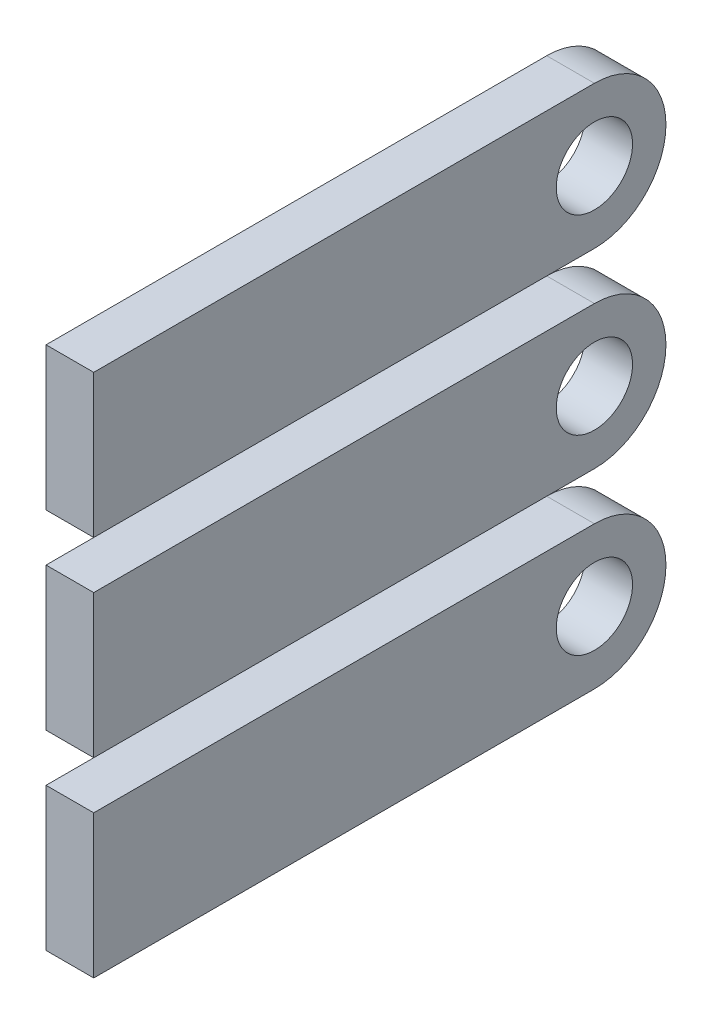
SolidWorks part; units mm, degrees
ref_plane "Přední rovina" through (0, 0, 0) normal (0, 0, 1) x (1, 0, 0)
ref_plane "Horní rovina" through (0, 0, 0) normal (0, 1, 0) x (1, 0, 0)
ref_plane "Pravá rovina" through (0, 0, 0) normal (1, 0, 0) x (0, 0, -1)
sketch "Skica1" plane through (0, 0, 0) normal (0, 0, 1) x (1, 0, 0)
  line L0 (0, 148.7514) -> (0, -162.0328) construction
  line L1 (-203.1858, 0) -> (251.9227, 0) construction
  line L2 (1.4, 79.8) -> (1.4, 78.4875)
  line L3 (0, 78.39) -> (0, 88.6)
  line L4 (-2.8, 88.6) -> (2.8, 88.6)
  line L5 (0, 88.6) -> (0, 80.4)
  line L6 (-1.9, 80.4) -> (1.9, 80.4)
  line L7 (0, 80.4) -> (0, 79.8)
  line L8 (6.5145, 80.1582) -> (10.2937, 79.761)
  line L9 (1.4, 79.8) -> (1.9, 80.4)
  line L10 (2.8, 88.6) -> (1.9, 80.4)
  line L11 (-1.4, 79.8) -> (-1.9, 80.4)
  line L12 (-2.8, 88.6) -> (-1.9, 80.4)
  line L13 (6.4766, 88.4073) -> (6.5145, 80.1582)
  line L14 (6.4766, 88.4073) -> (12.0459, 87.822)
  line L15 (12.0459, 87.822) -> (10.2937, 79.761)
  line L16 (6.949, 79.5092) -> (6.5145, 80.1582)
  line L17 (14.8576, 79.0381) -> (18.5746, 78.248)
  line L18 (9.7337, 79.2165) -> (10.2937, 79.761)
  line L19 (15.6822, 87.246) -> (14.8576, 79.0381)
  line L20 (15.6822, 87.246) -> (21.1598, 86.0817)
  line L21 (21.1598, 86.0817) -> (18.5746, 78.248)
  line L22 (15.2219, 78.3473) -> (14.8576, 79.0381)
  line L23 (23.038, 77.0521) -> (26.652, 75.8778)
  line L24 (17.9608, 77.7651) -> (18.5746, 78.248)
  line L25 (24.7159, 85.1289) -> (23.038, 77.0521)
  line L26 (24.7159, 85.1289) -> (30.0419, 83.3984)
  line L27 (30.0419, 83.3984) -> (26.652, 75.8778)
  line L28 (23.3281, 76.3269) -> (23.038, 77.0521)
  line L29 (30.9659, 74.2219) -> (34.4374, 72.6763)
  line L30 (25.991, 75.4617) -> (26.652, 75.8778)
  line L31 (33.4789, 82.079) -> (30.9659, 74.2219)
  line L32 (33.4789, 82.079) -> (38.5948, 79.8013)
  line L33 (38.5948, 79.8013) -> (34.4374, 72.6763)
  line L34 (31.1786, 73.4704) -> (30.9659, 74.2219)
  line L35 (38.5546, 70.5784) -> (41.8454, 68.6784)
  line L36 (33.7365, 72.3315) -> (34.4374, 72.6763)
  line L37 (41.8751, 78.1299) -> (38.5546, 70.5784)
  line L38 (41.8751, 78.1299) -> (46.7249, 75.3299)
  line L39 (46.7249, 75.3299) -> (41.8454, 68.6784)
  line L40 (38.6876, 69.8088) -> (38.5546, 70.5784)
  line L41 (45.7208, 66.1618) -> (48.7951, 63.9282)
  line L42 (41.1124, 68.4088) -> (41.8454, 68.6784)
  line L43 (49.8125, 73.3247) -> (45.7208, 66.1618)
  line L44 (49.8125, 73.3247) -> (54.343, 70.0331)
  line L45 (54.343, 70.0331) -> (48.7951, 63.9282)
  line L46 (45.7726, 65.3825) -> (45.7208, 66.1618)
  line L47 (52.3861, 61.0202) -> (55.2101, 58.4775)
  line L48 (48.0379, 63.7367) -> (48.7951, 63.9282)
  line L49 (57.2042, 67.7162) -> (52.3861, 61.0202)
  line L50 (57.2042, 67.7162) -> (61.3658, 63.9691)
  line L51 (61.3658, 63.9691) -> (55.2101, 58.4775)
  line L52 (52.3562, 60.2397) -> (52.3861, 61.0202)
  line L53 (58.4775, 55.2101) -> (61.0202, 52.3861)
  line L54 (54.437, 58.3662) -> (55.2101, 58.4775)
  line L55 (63.9691, 61.3658) -> (58.4775, 55.2101)
  line L56 (63.9691, 61.3658) -> (67.7162, 57.2042)
  line L57 (67.7162, 57.2042) -> (61.0202, 52.3861)
  line L58 (58.3662, 54.437) -> (58.4775, 55.2101)
  line L59 (63.9282, 48.7951) -> (66.1618, 45.7208)
  line L60 (60.2397, 52.3562) -> (61.0202, 52.3861)
  line L61 (70.0331, 54.343) -> (63.9282, 48.7951)
  line L62 (70.0331, 54.343) -> (73.3247, 49.8125)
  line L63 (73.3247, 49.8125) -> (66.1618, 45.7208)
  line L64 (63.7367, 48.0379) -> (63.9282, 48.7951)
  line L65 (68.6784, 41.8454) -> (70.5784, 38.5546)
  line L66 (65.3825, 45.7726) -> (66.1618, 45.7208)
  line L67 (75.3299, 46.7249) -> (68.6784, 41.8454)
  line L68 (75.3299, 46.7249) -> (78.1299, 41.8751)
  line L69 (78.1299, 41.8751) -> (70.5784, 38.5546)
  line L70 (68.4088, 41.1124) -> (68.6784, 41.8454)
  line L71 (72.6763, 34.4374) -> (74.2219, 30.9659)
  line L72 (69.8088, 38.6876) -> (70.5784, 38.5546)
  line L73 (79.8013, 38.5948) -> (72.6763, 34.4374)
  line L74 (79.8013, 38.5948) -> (82.079, 33.4789)
  line L75 (82.079, 33.4789) -> (74.2219, 30.9659)
  line L76 (72.3315, 33.7365) -> (72.6763, 34.4374)
  line L77 (75.8778, 26.652) -> (77.0521, 23.038)
  line L78 (73.4704, 31.1786) -> (74.2219, 30.9659)
  line L79 (83.3984, 30.0419) -> (75.8778, 26.652)
  line L80 (83.3984, 30.0419) -> (85.1289, 24.7159)
  line L81 (85.1289, 24.7159) -> (77.0521, 23.038)
  line L82 (75.4617, 25.991) -> (75.8778, 26.652)
  line L83 (78.248, 18.5746) -> (79.0381, 14.8576)
  line L84 (76.3269, 23.3281) -> (77.0521, 23.038)
  line L85 (86.0817, 21.1598) -> (78.248, 18.5746)
  line L86 (86.0817, 21.1598) -> (87.246, 15.6822)
  line L87 (87.246, 15.6822) -> (79.0381, 14.8576)
  line L88 (77.7651, 17.9608) -> (78.248, 18.5746)
  line L89 (79.761, 10.2937) -> (80.1582, 6.5145)
  line L90 (78.3473, 15.2219) -> (79.0381, 14.8576)
  line L91 (87.822, 12.0459) -> (79.761, 10.2937)
  line L92 (87.822, 12.0459) -> (88.4073, 6.4766)
  line L93 (88.4073, 6.4766) -> (80.1582, 6.5145)
  line L94 (79.2165, 9.7337) -> (79.761, 10.2937)
  line L95 (80.4, 1.9) -> (80.4, -1.9)
  line L96 (79.5092, 6.949) -> (80.1582, 6.5145)
  line L97 (88.6, 2.8) -> (80.4, 1.9)
  line L98 (88.6, 2.8) -> (88.6, -2.8)
  line L99 (88.6, -2.8) -> (80.4, -1.9)
  line L100 (79.8, 1.4) -> (80.4, 1.9)
  line L101 (80.1582, -6.5145) -> (79.761, -10.2937)
  line L102 (79.8, -1.4) -> (80.4, -1.9)
  line L103 (88.4073, -6.4766) -> (80.1582, -6.5145)
  line L104 (88.4073, -6.4766) -> (87.822, -12.0459)
  line L105 (87.822, -12.0459) -> (79.761, -10.2937)
  line L106 (79.5092, -6.949) -> (80.1582, -6.5145)
  line L107 (79.0381, -14.8576) -> (78.248, -18.5746)
  line L108 (79.2165, -9.7337) -> (79.761, -10.2937)
  line L109 (87.246, -15.6822) -> (79.0381, -14.8576)
  line L110 (87.246, -15.6822) -> (86.0817, -21.1598)
  line L111 (86.0817, -21.1598) -> (78.248, -18.5746)
  line L112 (78.3473, -15.2219) -> (79.0381, -14.8576)
  line L113 (77.0521, -23.038) -> (75.8778, -26.652)
  line L114 (77.7651, -17.9608) -> (78.248, -18.5746)
  line L115 (85.1289, -24.7159) -> (77.0521, -23.038)
  line L116 (85.1289, -24.7159) -> (83.3984, -30.0419)
  line L117 (83.3984, -30.0419) -> (75.8778, -26.652)
  line L118 (76.3269, -23.3281) -> (77.0521, -23.038)
  line L119 (74.2219, -30.9659) -> (72.6763, -34.4374)
  line L120 (75.4617, -25.991) -> (75.8778, -26.652)
  line L121 (82.079, -33.4789) -> (74.2219, -30.9659)
  line L122 (82.079, -33.4789) -> (79.8013, -38.5948)
  line L123 (79.8013, -38.5948) -> (72.6763, -34.4374)
  line L124 (73.4704, -31.1786) -> (74.2219, -30.9659)
  line L125 (70.5784, -38.5546) -> (68.6784, -41.8454)
  line L126 (72.3315, -33.7365) -> (72.6763, -34.4374)
  line L127 (78.1299, -41.8751) -> (70.5784, -38.5546)
  line L128 (78.1299, -41.8751) -> (75.3299, -46.7249)
  line L129 (75.3299, -46.7249) -> (68.6784, -41.8454)
  line L130 (69.8088, -38.6876) -> (70.5784, -38.5546)
  line L131 (66.1618, -45.7208) -> (63.9282, -48.7951)
  line L132 (68.4088, -41.1124) -> (68.6784, -41.8454)
  line L133 (73.3247, -49.8125) -> (66.1618, -45.7208)
  line L134 (73.3247, -49.8125) -> (70.0331, -54.343)
  line L135 (70.0331, -54.343) -> (63.9282, -48.7951)
  line L136 (65.3825, -45.7726) -> (66.1618, -45.7208)
  line L137 (61.0202, -52.3861) -> (58.4775, -55.2101)
  line L138 (63.7367, -48.0379) -> (63.9282, -48.7951)
  line L139 (67.7162, -57.2042) -> (61.0202, -52.3861)
  line L140 (67.7162, -57.2042) -> (63.9691, -61.3658)
  line L141 (63.9691, -61.3658) -> (58.4775, -55.2101)
  line L142 (60.2397, -52.3562) -> (61.0202, -52.3861)
  line L143 (55.2101, -58.4775) -> (52.3861, -61.0202)
  line L144 (58.3662, -54.437) -> (58.4775, -55.2101)
  line L145 (61.3658, -63.9691) -> (55.2101, -58.4775)
  line L146 (61.3658, -63.9691) -> (57.2042, -67.7162)
  line L147 (57.2042, -67.7162) -> (52.3861, -61.0202)
  line L148 (54.437, -58.3662) -> (55.2101, -58.4775)
  line L149 (48.7951, -63.9282) -> (45.7208, -66.1618)
  line L150 (52.3562, -60.2397) -> (52.3861, -61.0202)
  line L151 (54.343, -70.0331) -> (48.7951, -63.9282)
  line L152 (54.343, -70.0331) -> (49.8125, -73.3247)
  line L153 (49.8125, -73.3247) -> (45.7208, -66.1618)
  line L154 (48.0379, -63.7367) -> (48.7951, -63.9282)
  line L155 (41.8454, -68.6784) -> (38.5546, -70.5784)
  line L156 (45.7726, -65.3825) -> (45.7208, -66.1618)
  line L157 (46.7249, -75.3299) -> (41.8454, -68.6784)
  line L158 (46.7249, -75.3299) -> (41.8751, -78.1299)
  line L159 (41.8751, -78.1299) -> (38.5546, -70.5784)
  line L160 (41.1124, -68.4088) -> (41.8454, -68.6784)
  line L161 (34.4374, -72.6763) -> (30.9659, -74.2219)
  line L162 (38.6876, -69.8088) -> (38.5546, -70.5784)
  line L163 (38.5948, -79.8013) -> (34.4374, -72.6763)
  line L164 (38.5948, -79.8013) -> (33.4789, -82.079)
  line L165 (33.4789, -82.079) -> (30.9659, -74.2219)
  line L166 (33.7365, -72.3315) -> (34.4374, -72.6763)
  line L167 (26.652, -75.8778) -> (23.038, -77.0521)
  line L168 (31.1786, -73.4704) -> (30.9659, -74.2219)
  line L169 (30.0419, -83.3984) -> (26.652, -75.8778)
  line L170 (30.0419, -83.3984) -> (24.7159, -85.1289)
  line L171 (24.7159, -85.1289) -> (23.038, -77.0521)
  line L172 (25.991, -75.4617) -> (26.652, -75.8778)
  line L173 (18.5746, -78.248) -> (14.8576, -79.0381)
  line L174 (23.3281, -76.3269) -> (23.038, -77.0521)
  line L175 (21.1598, -86.0817) -> (18.5746, -78.248)
  line L176 (21.1598, -86.0817) -> (15.6822, -87.246)
  line L177 (15.6822, -87.246) -> (14.8576, -79.0381)
  line L178 (17.9608, -77.7651) -> (18.5746, -78.248)
  line L179 (10.2937, -79.761) -> (6.5145, -80.1582)
  line L180 (15.2219, -78.3473) -> (14.8576, -79.0381)
  line L181 (12.0459, -87.822) -> (10.2937, -79.761)
  line L182 (12.0459, -87.822) -> (6.4766, -88.4073)
  line L183 (6.4766, -88.4073) -> (6.5145, -80.1582)
  line L184 (9.7337, -79.2165) -> (10.2937, -79.761)
  line L185 (1.9, -80.4) -> (-1.9, -80.4)
  line L186 (6.949, -79.5092) -> (6.5145, -80.1582)
  line L187 (2.8, -88.6) -> (1.9, -80.4)
  line L188 (2.8, -88.6) -> (-2.8, -88.6)
  line L189 (-2.8, -88.6) -> (-1.9, -80.4)
  line L190 (1.4, -79.8) -> (1.9, -80.4)
  line L191 (-6.5145, -80.1582) -> (-10.2937, -79.761)
  line L192 (-1.4, -79.8) -> (-1.9, -80.4)
  line L193 (-6.4766, -88.4073) -> (-6.5145, -80.1582)
  line L194 (-6.4766, -88.4073) -> (-12.0459, -87.822)
  line L195 (-12.0459, -87.822) -> (-10.2937, -79.761)
  line L196 (-6.949, -79.5092) -> (-6.5145, -80.1582)
  line L197 (-14.8576, -79.0381) -> (-18.5746, -78.248)
  line L198 (-9.7337, -79.2165) -> (-10.2937, -79.761)
  line L199 (-15.6822, -87.246) -> (-14.8576, -79.0381)
  line L200 (-15.6822, -87.246) -> (-21.1598, -86.0817)
  line L201 (-21.1598, -86.0817) -> (-18.5746, -78.248)
  line L202 (-15.2219, -78.3473) -> (-14.8576, -79.0381)
  line L203 (-23.038, -77.0521) -> (-26.652, -75.8778)
  line L204 (-17.9608, -77.7651) -> (-18.5746, -78.248)
  line L205 (-24.7159, -85.1289) -> (-23.038, -77.0521)
  line L206 (-24.7159, -85.1289) -> (-30.0419, -83.3984)
  line L207 (-30.0419, -83.3984) -> (-26.652, -75.8778)
  line L208 (-23.3281, -76.3269) -> (-23.038, -77.0521)
  line L209 (-30.9659, -74.2219) -> (-34.4374, -72.6763)
  line L210 (-25.991, -75.4617) -> (-26.652, -75.8778)
  line L211 (-33.4789, -82.079) -> (-30.9659, -74.2219)
  line L212 (-33.4789, -82.079) -> (-38.5948, -79.8013)
  line L213 (-38.5948, -79.8013) -> (-34.4374, -72.6763)
  line L214 (-31.1786, -73.4704) -> (-30.9659, -74.2219)
  line L215 (-38.5546, -70.5784) -> (-41.8454, -68.6784)
  line L216 (-33.7365, -72.3315) -> (-34.4374, -72.6763)
  line L217 (-41.8751, -78.1299) -> (-38.5546, -70.5784)
  line L218 (-41.8751, -78.1299) -> (-46.7249, -75.3299)
  line L219 (-46.7249, -75.3299) -> (-41.8454, -68.6784)
  line L220 (-38.6876, -69.8088) -> (-38.5546, -70.5784)
  line L221 (-45.7208, -66.1618) -> (-48.7951, -63.9282)
  line L222 (-41.1124, -68.4088) -> (-41.8454, -68.6784)
  line L223 (-49.8125, -73.3247) -> (-45.7208, -66.1618)
  line L224 (-49.8125, -73.3247) -> (-54.343, -70.0331)
  line L225 (-54.343, -70.0331) -> (-48.7951, -63.9282)
  line L226 (-45.7726, -65.3825) -> (-45.7208, -66.1618)
  line L227 (-45.7726, -65.3825) -> (-48.0379, -63.7367)
  line L228 (-48.0379, -63.7367) -> (-48.7951, -63.9282)
  line L229 (-57.2042, -67.7162) -> (-52.3861, -61.0202)
  line L230 (-57.2042, -67.7162) -> (-61.3658, -63.9691)
  line L231 (-61.3658, -63.9691) -> (-55.2101, -58.4775)
  line L232 (-52.3562, -60.2397) -> (-52.3861, -61.0202)
  line L233 (-52.3861, -61.0202) -> (-55.2101, -58.4775)
  line L234 (-54.437, -58.3662) -> (-55.2101, -58.4775)
  line L235 (-63.9691, -61.3658) -> (-58.4775, -55.2101)
  line L236 (-63.9691, -61.3658) -> (-67.7162, -57.2042)
  line L237 (-67.7162, -57.2042) -> (-61.0202, -52.3861)
  line L238 (-58.3662, -54.437) -> (-58.4775, -55.2101)
  line L239 (-58.4775, -55.2101) -> (-61.0202, -52.3861)
  line L240 (-60.2397, -52.3562) -> (-61.0202, -52.3861)
  line L241 (-70.0331, -54.343) -> (-63.9282, -48.7951)
  line L242 (-70.0331, -54.343) -> (-73.3247, -49.8125)
  line L243 (-73.3247, -49.8125) -> (-66.1618, -45.7208)
  line L244 (-63.7367, -48.0379) -> (-63.9282, -48.7951)
  line L245 (-63.9282, -48.7951) -> (-66.1618, -45.7208)
  line L246 (-65.3825, -45.7726) -> (-66.1618, -45.7208)
  line L247 (-75.3299, -46.7249) -> (-68.6784, -41.8454)
  line L248 (-75.3299, -46.7249) -> (-78.1299, -41.8751)
  line L249 (-78.1299, -41.8751) -> (-70.5784, -38.5546)
  line L250 (-68.4088, -41.1124) -> (-68.6784, -41.8454)
  line L251 (-68.6784, -41.8454) -> (-70.5784, -38.5546)
  line L252 (-69.8088, -38.6876) -> (-70.5784, -38.5546)
  line L253 (-79.8013, -38.5948) -> (-72.6763, -34.4374)
  line L254 (-79.8013, -38.5948) -> (-82.079, -33.4789)
  line L255 (-82.079, -33.4789) -> (-74.2219, -30.9659)
  line L256 (-72.3315, -33.7365) -> (-72.6763, -34.4374)
  line L257 (-72.6763, -34.4374) -> (-74.2219, -30.9659)
  line L258 (-73.4704, -31.1786) -> (-74.2219, -30.9659)
  line L259 (-83.3984, -30.0419) -> (-75.8778, -26.652)
  line L260 (-83.3984, -30.0419) -> (-85.1289, -24.7159)
  line L261 (-85.1289, -24.7159) -> (-77.0521, -23.038)
  line L262 (-75.4617, -25.991) -> (-75.8778, -26.652)
  line L263 (-75.4617, -25.991) -> (-76.3269, -23.3281)
  line L264 (-76.3269, -23.3281) -> (-77.0521, -23.038)
  line L265 (-86.0817, -21.1598) -> (-78.248, -18.5746)
  line L266 (-86.0817, -21.1598) -> (-87.246, -15.6822)
  line L267 (-87.246, -15.6822) -> (-79.0381, -14.8576)
  line L268 (-77.7651, -17.9608) -> (-78.248, -18.5746)
  line L269 (-77.7651, -17.9608) -> (-78.3473, -15.2219)
  line L270 (-78.3473, -15.2219) -> (-79.0381, -14.8576)
  line L271 (-87.822, -12.0459) -> (-79.761, -10.2937)
  line L272 (-87.822, -12.0459) -> (-88.4073, -6.4766)
  line L273 (-88.4073, -6.4766) -> (-80.1582, -6.5145)
  line L274 (-79.2165, -9.7337) -> (-79.761, -10.2937)
  line L275 (-75.8778, -26.652) -> (-77.0521, -23.038)
  line L276 (-79.5092, -6.949) -> (-80.1582, -6.5145)
  line L277 (-88.6, -2.8) -> (-80.4, -1.9)
  line L278 (-88.6, -2.8) -> (-88.6, 2.8)
  line L279 (-88.6, 2.8) -> (-80.4, 1.9)
  line L280 (-79.8, -1.4) -> (-80.4, -1.9)
  line L281 (-78.248, -18.5746) -> (-79.0381, -14.8576)
  line L282 (-79.8, 1.4) -> (-80.4, 1.9)
  line L283 (-88.4073, 6.4766) -> (-80.1582, 6.5145)
  line L284 (-88.4073, 6.4766) -> (-87.822, 12.0459)
  line L285 (-87.822, 12.0459) -> (-79.761, 10.2937)
  line L286 (-79.5092, 6.949) -> (-80.1582, 6.5145)
  line L287 (-79.761, -10.2937) -> (-80.1582, -6.5145)
  line L288 (-79.2165, 9.7337) -> (-79.761, 10.2937)
  line L289 (-87.246, 15.6822) -> (-79.0381, 14.8576)
  line L290 (-87.246, 15.6822) -> (-86.0817, 21.1598)
  line L291 (-86.0817, 21.1598) -> (-78.248, 18.5746)
  line L292 (-78.3473, 15.2219) -> (-79.0381, 14.8576)
  line L293 (-80.4, -1.9) -> (-80.4, 1.9)
  line L294 (-77.7651, 17.9608) -> (-78.248, 18.5746)
  line L295 (-85.1289, 24.7159) -> (-77.0521, 23.038)
  line L296 (-85.1289, 24.7159) -> (-83.3984, 30.0419)
  line L297 (-83.3984, 30.0419) -> (-75.8778, 26.652)
  line L298 (-76.3269, 23.3281) -> (-77.0521, 23.038)
  line L299 (-80.1582, 6.5145) -> (-79.761, 10.2937)
  line L300 (-75.4617, 25.991) -> (-75.8778, 26.652)
  line L301 (-82.079, 33.4789) -> (-74.2219, 30.9659)
  line L302 (-82.079, 33.4789) -> (-79.8013, 38.5948)
  line L303 (-79.8013, 38.5948) -> (-72.6763, 34.4374)
  line L304 (-73.4704, 31.1786) -> (-74.2219, 30.9659)
  line L305 (-79.0381, 14.8576) -> (-78.248, 18.5746)
  line L306 (-72.3315, 33.7365) -> (-72.6763, 34.4374)
  line L307 (-78.1299, 41.8751) -> (-70.5784, 38.5546)
  line L308 (-78.1299, 41.8751) -> (-75.3299, 46.7249)
  line L309 (-75.3299, 46.7249) -> (-68.6784, 41.8454)
  line L310 (-69.8088, 38.6876) -> (-70.5784, 38.5546)
  line L311 (-77.0521, 23.038) -> (-75.8778, 26.652)
  line L312 (-68.4088, 41.1124) -> (-68.6784, 41.8454)
  line L313 (-73.3247, 49.8125) -> (-66.1618, 45.7208)
  line L314 (-73.3247, 49.8125) -> (-70.0331, 54.343)
  line L315 (-70.0331, 54.343) -> (-63.9282, 48.7951)
  line L316 (-65.3825, 45.7726) -> (-66.1618, 45.7208)
  line L317 (-74.2219, 30.9659) -> (-72.6763, 34.4374)
  line L318 (-63.7367, 48.0379) -> (-63.9282, 48.7951)
  line L319 (-67.7162, 57.2042) -> (-61.0202, 52.3861)
  line L320 (-67.7162, 57.2042) -> (-63.9691, 61.3658)
  line L321 (-63.9691, 61.3658) -> (-58.4775, 55.2101)
  line L322 (-60.2397, 52.3562) -> (-61.0202, 52.3861)
  line L323 (-70.5784, 38.5546) -> (-68.6784, 41.8454)
  line L324 (-58.3662, 54.437) -> (-58.4775, 55.2101)
  line L325 (-61.3658, 63.9691) -> (-55.2101, 58.4775)
  line L326 (-61.3658, 63.9691) -> (-57.2042, 67.7162)
  line L327 (-57.2042, 67.7162) -> (-52.3861, 61.0202)
  line L328 (-54.437, 58.3662) -> (-55.2101, 58.4775)
  line L329 (-66.1618, 45.7208) -> (-63.9282, 48.7951)
  line L330 (-52.3562, 60.2397) -> (-52.3861, 61.0202)
  line L331 (-54.343, 70.0331) -> (-48.7951, 63.9282)
  line L332 (-54.343, 70.0331) -> (-49.8125, 73.3247)
  line L333 (-49.8125, 73.3247) -> (-45.7208, 66.1618)
  line L334 (-48.0379, 63.7367) -> (-48.7951, 63.9282)
  line L335 (-61.0202, 52.3861) -> (-58.4775, 55.2101)
  line L336 (-45.7726, 65.3825) -> (-45.7208, 66.1618)
  line L337 (-46.7249, 75.3299) -> (-41.8454, 68.6784)
  line L338 (-46.7249, 75.3299) -> (-41.8751, 78.1299)
  line L339 (-41.8751, 78.1299) -> (-38.5546, 70.5784)
  line L340 (-41.1124, 68.4088) -> (-41.8454, 68.6784)
  line L341 (-55.2101, 58.4775) -> (-52.3861, 61.0202)
  line L342 (-38.6876, 69.8088) -> (-38.5546, 70.5784)
  line L343 (-38.5948, 79.8013) -> (-34.4374, 72.6763)
  line L344 (-38.5948, 79.8013) -> (-33.4789, 82.079)
  line L345 (-33.4789, 82.079) -> (-30.9659, 74.2219)
  line L346 (-33.7365, 72.3315) -> (-34.4374, 72.6763)
  line L347 (-48.7951, 63.9282) -> (-45.7208, 66.1618)
  line L348 (-31.1786, 73.4704) -> (-30.9659, 74.2219)
  line L349 (-30.0419, 83.3984) -> (-26.652, 75.8778)
  line L350 (-30.0419, 83.3984) -> (-24.7159, 85.1289)
  line L351 (-24.7159, 85.1289) -> (-23.038, 77.0521)
  line L352 (-25.991, 75.4617) -> (-26.652, 75.8778)
  line L353 (-41.8454, 68.6784) -> (-38.5546, 70.5784)
  line L354 (-23.3281, 76.3269) -> (-23.038, 77.0521)
  line L355 (-21.1598, 86.0817) -> (-18.5746, 78.248)
  line L356 (-21.1598, 86.0817) -> (-15.6822, 87.246)
  line L357 (-15.6822, 87.246) -> (-14.8576, 79.0381)
  line L358 (-17.9608, 77.7651) -> (-18.5746, 78.248)
  line L359 (-34.4374, 72.6763) -> (-30.9659, 74.2219)
  line L360 (-15.2219, 78.3473) -> (-14.8576, 79.0381)
  line L361 (-12.0459, 87.822) -> (-10.2937, 79.761)
  line L362 (-12.0459, 87.822) -> (-6.4766, 88.4073)
  line L363 (-6.4766, 88.4073) -> (-6.5145, 80.1582)
  line L364 (-9.7337, 79.2165) -> (-10.2937, 79.761)
  line L365 (-26.652, 75.8778) -> (-23.038, 77.0521)
  line L366 (-6.949, 79.5092) -> (-6.5145, 80.1582)
  line L367 (-1.4, 79.8) -> (-1.4, 78.4875)
  line L368 (6.949, 79.5092) -> (6.8118, 78.2039)
  line L369 (9.7337, 79.2165) -> (9.5965, 77.9112)
  line L370 (15.2219, 78.3473) -> (14.9491, 77.0635)
  line L371 (17.9608, 77.7651) -> (17.6879, 76.4813)
  line L372 (23.3281, 76.3269) -> (22.9225, 75.0787)
  line L373 (25.991, 75.4617) -> (25.5855, 74.2134)
  line L374 (31.1786, 73.4704) -> (30.6448, 72.2713)
  line L375 (33.7365, 72.3315) -> (33.2027, 71.1325)
  line L376 (38.6876, 69.8088) -> (38.0313, 68.6722)
  line L377 (41.1124, 68.4088) -> (40.4562, 67.2722)
  line L378 (45.7726, 65.3825) -> (45.0012, 64.3206)
  line L379 (48.0379, 63.7367) -> (47.2664, 62.6748)
  line L380 (52.3562, 60.2397) -> (51.478, 59.2644)
  line L381 (54.437, 58.3662) -> (53.5588, 57.3908)
  line L382 (58.3662, 54.437) -> (57.3908, 53.5588)
  line L383 (60.2397, 52.3562) -> (59.2644, 51.478)
  line L384 (63.7367, 48.0379) -> (62.6748, 47.2664)
  line L385 (65.3825, 45.7726) -> (64.3206, 45.0012)
  line L386 (68.4088, 41.1124) -> (67.2722, 40.4562)
  line L387 (69.8088, 38.6876) -> (68.6722, 38.0313)
  line L388 (72.3315, 33.7365) -> (71.1325, 33.2027)
  line L389 (73.4704, 31.1786) -> (72.2713, 30.6448)
  line L390 (75.4617, 25.991) -> (74.2134, 25.5855)
  line L391 (76.3269, 23.3281) -> (75.0787, 22.9225)
  line L392 (77.7651, 17.9608) -> (76.4813, 17.6879)
  line L393 (78.3473, 15.2219) -> (77.0635, 14.9491)
  line L394 (79.2165, 9.7337) -> (77.9112, 9.5965)
  line L395 (79.5092, 6.949) -> (78.2039, 6.8118)
  line L396 (79.8, 1.4) -> (78.4875, 1.4)
  line L397 (79.8, -1.4) -> (78.4875, -1.4)
  line L398 (79.5092, -6.949) -> (78.2039, -6.8118)
  line L399 (79.2165, -9.7337) -> (77.9112, -9.5965)
  line L400 (78.3473, -15.2219) -> (77.0635, -14.9491)
  line L401 (77.7651, -17.9608) -> (76.4813, -17.6879)
  line L402 (76.3269, -23.3281) -> (75.0787, -22.9225)
  line L403 (75.4617, -25.991) -> (74.2134, -25.5855)
  line L404 (73.4704, -31.1786) -> (72.2713, -30.6448)
  line L405 (72.3315, -33.7365) -> (71.1325, -33.2027)
  line L406 (69.8088, -38.6876) -> (68.6722, -38.0313)
  line L407 (68.4088, -41.1124) -> (67.2722, -40.4562)
  line L408 (65.3825, -45.7726) -> (64.3206, -45.0012)
  line L409 (63.7367, -48.0379) -> (62.6748, -47.2664)
  line L410 (60.2397, -52.3562) -> (59.2644, -51.478)
  line L411 (58.3662, -54.437) -> (57.3908, -53.5588)
  line L412 (54.437, -58.3662) -> (53.5588, -57.3908)
  line L413 (52.3562, -60.2397) -> (51.478, -59.2644)
  line L414 (48.0379, -63.7367) -> (47.2664, -62.6748)
  line L415 (45.7726, -65.3825) -> (45.0012, -64.3206)
  line L416 (41.1124, -68.4088) -> (40.4562, -67.2722)
  line L417 (38.6876, -69.8088) -> (38.0313, -68.6722)
  line L418 (33.7365, -72.3315) -> (33.2027, -71.1325)
  line L419 (31.1786, -73.4704) -> (30.6448, -72.2713)
  line L420 (25.991, -75.4617) -> (25.5855, -74.2134)
  line L421 (23.3281, -76.3269) -> (22.9225, -75.0787)
  line L422 (17.9608, -77.7651) -> (17.6879, -76.4813)
  line L423 (15.2219, -78.3473) -> (14.9491, -77.0635)
  line L424 (9.7337, -79.2165) -> (9.5965, -77.9112)
  line L425 (6.949, -79.5092) -> (6.8118, -78.2039)
  line L426 (1.4, -79.8) -> (1.4, -78.4875)
  line L427 (-1.4, -79.8) -> (-1.4, -78.4875)
  line L428 (-6.949, -79.5092) -> (-6.8118, -78.2039)
  line L429 (-9.7337, -79.2165) -> (-9.5965, -77.9112)
  line L430 (-15.2219, -78.3473) -> (-14.9491, -77.0635)
  line L431 (-17.9608, -77.7651) -> (-17.6879, -76.4813)
  line L432 (-23.3281, -76.3269) -> (-22.9225, -75.0787)
  line L433 (-25.991, -75.4617) -> (-25.5855, -74.2134)
  line L434 (-31.1786, -73.4704) -> (-30.6448, -72.2713)
  line L435 (-33.7365, -72.3315) -> (-33.2027, -71.1325)
  line L436 (-38.6876, -69.8088) -> (-38.0313, -68.6722)
  line L437 (-41.1124, -68.4088) -> (-40.4562, -67.2722)
  line L438 (-45.7726, -65.3825) -> (-45.0012, -64.3206)
  line L439 (-48.0379, -63.7367) -> (-47.2664, -62.6748)
  line L440 (-52.3562, -60.2397) -> (-51.478, -59.2644)
  line L441 (-54.437, -58.3662) -> (-53.5588, -57.3908)
  line L442 (-58.3662, -54.437) -> (-57.3908, -53.5588)
  line L443 (-60.2397, -52.3562) -> (-59.2644, -51.478)
  line L444 (-63.7367, -48.0379) -> (-62.6748, -47.2664)
  line L445 (-65.3825, -45.7726) -> (-64.3206, -45.0012)
  line L446 (-68.4088, -41.1124) -> (-67.2722, -40.4562)
  line L447 (-69.8088, -38.6876) -> (-68.6722, -38.0313)
  line L448 (-72.3315, -33.7365) -> (-71.1325, -33.2027)
  line L449 (-73.4704, -31.1786) -> (-72.2713, -30.6448)
  line L450 (-75.4617, -25.991) -> (-74.2134, -25.5855)
  line L451 (-76.3269, -23.3281) -> (-75.0787, -22.9225)
  line L452 (-77.7651, -17.9608) -> (-76.4813, -17.6879)
  line L453 (-78.3473, -15.2219) -> (-77.0635, -14.9491)
  line L454 (-79.2165, -9.7337) -> (-77.9112, -9.5965)
  line L455 (-79.5092, -6.949) -> (-78.2039, -6.8118)
  line L456 (-79.8, -1.4) -> (-78.4875, -1.4)
  line L457 (-79.8, 1.4) -> (-78.4875, 1.4)
  line L458 (-79.5092, 6.949) -> (-78.2039, 6.8118)
  line L459 (-79.2165, 9.7337) -> (-77.9112, 9.5965)
  line L460 (-78.3473, 15.2219) -> (-77.0635, 14.9491)
  line L461 (-77.7651, 17.9608) -> (-76.4813, 17.6879)
  line L462 (-76.3269, 23.3281) -> (-75.0787, 22.9225)
  line L463 (-75.4617, 25.991) -> (-74.2134, 25.5855)
  line L464 (-73.4704, 31.1786) -> (-72.2713, 30.6448)
  line L465 (-72.3315, 33.7365) -> (-71.1325, 33.2027)
  line L466 (-69.8088, 38.6876) -> (-68.6722, 38.0313)
  line L467 (-68.4088, 41.1124) -> (-67.2722, 40.4562)
  line L468 (-65.3825, 45.7726) -> (-64.3206, 45.0012)
  line L469 (-63.7367, 48.0379) -> (-62.6748, 47.2664)
  line L470 (-60.2397, 52.3562) -> (-59.2644, 51.478)
  line L471 (-58.3662, 54.437) -> (-57.3908, 53.5588)
  line L472 (-54.437, 58.3662) -> (-53.5588, 57.3908)
  line L473 (-52.3562, 60.2397) -> (-51.478, 59.2644)
  line L474 (-48.0379, 63.7367) -> (-47.2664, 62.6748)
  line L475 (-45.7726, 65.3825) -> (-45.0012, 64.3206)
  line L476 (-41.1124, 68.4088) -> (-40.4562, 67.2722)
  line L477 (-38.6876, 69.8088) -> (-38.0313, 68.6722)
  line L478 (-33.7365, 72.3315) -> (-33.2027, 71.1325)
  line L479 (-31.1786, 73.4704) -> (-30.6448, 72.2713)
  line L480 (-25.991, 75.4617) -> (-25.5855, 74.2134)
  line L481 (-23.3281, 76.3269) -> (-22.9225, 75.0787)
  line L482 (-17.9608, 77.7651) -> (-17.6879, 76.4813)
  line L483 (-15.2219, 78.3473) -> (-14.9491, 77.0635)
  line L484 (-9.7337, 79.2165) -> (-9.5965, 77.9112)
  line L485 (-6.949, 79.5092) -> (-6.8118, 78.2039)
  line L486 (-18.5746, 78.248) -> (-14.8576, 79.0381)
  line L487 (-10.2937, 79.761) -> (-6.5145, 80.1582)
  arc A0 (-1.4, 78.4875) -> (-6.8118, 78.2039) centre (0, 0) ccw
  circle A1 centre (0, 0) radius 127
  arc A2 (-9.5965, 77.9112) -> (-14.9491, 77.0635) centre (0, 0) ccw
  arc A3 (-17.6879, 76.4813) -> (-22.9225, 75.0787) centre (0, 0) ccw
  arc A4 (-25.5855, 74.2134) -> (-30.6448, 72.2713) centre (0, 0) ccw
  arc A5 (6.8118, 78.2039) -> (1.4, 78.4875) centre (0, 0) ccw
  arc A6 (14.9491, 77.0635) -> (9.5965, 77.9112) centre (0, 0) ccw
  arc A7 (-33.2027, 71.1325) -> (-38.0313, 68.6722) centre (0, 0) ccw
  arc A8 (-40.4562, 67.2722) -> (-45.0012, 64.3206) centre (0, 0) ccw
  arc A9 (-47.2664, 62.6748) -> (-51.478, 59.2644) centre (0, 0) ccw
  arc A10 (-53.5588, 57.3908) -> (-57.3908, 53.5588) centre (0, 0) ccw
  arc A11 (-59.2644, 51.478) -> (-62.6748, 47.2664) centre (0, 0) ccw
  arc A12 (-64.3206, 45.0012) -> (-67.2722, 40.4562) centre (0, 0) ccw
  arc A13 (-68.6722, 38.0313) -> (-71.1325, 33.2027) centre (0, 0) ccw
  arc A14 (-72.2713, 30.6448) -> (-74.2134, 25.5855) centre (0, 0) ccw
  arc A15 (-75.0787, 22.9225) -> (-76.4813, 17.6879) centre (0, 0) ccw
  arc A16 (-77.0635, 14.9491) -> (-77.9112, 9.5965) centre (0, 0) ccw
  arc A17 (-78.2039, 6.8118) -> (-78.4875, 1.4) centre (0, 0) ccw
  arc A18 (-78.4875, -1.4) -> (-78.2039, -6.8118) centre (0, 0) ccw
  arc A19 (-77.9112, -9.5965) -> (-77.0635, -14.9491) centre (0, 0) ccw
  arc A20 (-76.4813, -17.6879) -> (-75.0787, -22.9225) centre (0, 0) ccw
  arc A21 (-74.2134, -25.5855) -> (-72.2713, -30.6448) centre (0, 0) ccw
  arc A22 (-71.1325, -33.2027) -> (-68.6722, -38.0313) centre (0, 0) ccw
  arc A23 (-67.2722, -40.4562) -> (-64.3206, -45.0012) centre (0, 0) ccw
  arc A24 (-62.6748, -47.2664) -> (-59.2644, -51.478) centre (0, 0) ccw
  arc A25 (-57.3908, -53.5588) -> (-53.5588, -57.3908) centre (0, 0) ccw
  arc A26 (-51.478, -59.2644) -> (-47.2664, -62.6748) centre (0, 0) ccw
  arc A27 (-45.0012, -64.3206) -> (-40.4562, -67.2722) centre (0, 0) ccw
  arc A28 (-38.0313, -68.6722) -> (-33.2027, -71.1325) centre (0, 0) ccw
  arc A29 (-30.6448, -72.2713) -> (-25.5855, -74.2134) centre (0, 0) ccw
  arc A30 (-22.9225, -75.0787) -> (-17.6879, -76.4813) centre (0, 0) ccw
  arc A31 (-14.9491, -77.0635) -> (-9.5965, -77.9112) centre (0, 0) ccw
  arc A32 (-6.8118, -78.2039) -> (-1.4, -78.4875) centre (0, 0) ccw
  arc A33 (1.4, -78.4875) -> (6.8118, -78.2039) centre (0, 0) ccw
  arc A34 (9.5965, -77.9112) -> (14.9491, -77.0635) centre (0, 0) ccw
  arc A35 (17.6879, -76.4813) -> (22.9225, -75.0787) centre (0, 0) ccw
  arc A36 (25.5855, -74.2134) -> (30.6448, -72.2713) centre (0, 0) ccw
  arc A37 (33.2027, -71.1325) -> (38.0313, -68.6722) centre (0, 0) ccw
  arc A38 (40.4562, -67.2722) -> (45.0012, -64.3206) centre (0, 0) ccw
  arc A39 (47.2664, -62.6748) -> (51.478, -59.2644) centre (0, 0) ccw
  arc A40 (53.5588, -57.3908) -> (57.3908, -53.5588) centre (0, 0) ccw
  arc A41 (59.2644, -51.478) -> (62.6748, -47.2664) centre (0, 0) ccw
  arc A42 (64.3206, -45.0012) -> (67.2722, -40.4562) centre (0, 0) ccw
  arc A43 (68.6722, -38.0313) -> (71.1325, -33.2027) centre (0, 0) ccw
  arc A44 (72.2713, -30.6448) -> (74.2134, -25.5855) centre (0, 0) ccw
  arc A45 (75.0787, -22.9225) -> (76.4813, -17.6879) centre (0, 0) ccw
  arc A46 (77.0635, -14.9491) -> (77.9112, -9.5965) centre (0, 0) ccw
  arc A47 (78.2039, -6.8118) -> (78.4875, -1.4) centre (0, 0) ccw
  arc A48 (78.4875, 1.4) -> (78.2039, 6.8118) centre (0, 0) ccw
  arc A49 (77.9112, 9.5965) -> (77.0635, 14.9491) centre (0, 0) ccw
  arc A50 (76.4813, 17.6879) -> (75.0787, 22.9225) centre (0, 0) ccw
  arc A51 (74.2134, 25.5855) -> (72.2713, 30.6448) centre (0, 0) ccw
  arc A52 (71.1325, 33.2027) -> (68.6722, 38.0313) centre (0, 0) ccw
  arc A53 (67.2722, 40.4562) -> (64.3206, 45.0012) centre (0, 0) ccw
  arc A54 (62.6748, 47.2664) -> (59.2644, 51.478) centre (0, 0) ccw
  arc A55 (22.9225, 75.0787) -> (17.6879, 76.4813) centre (0, 0) ccw
  arc A56 (30.6448, 72.2713) -> (25.5855, 74.2134) centre (0, 0) ccw
  arc A57 (38.0313, 68.6722) -> (33.2027, 71.1325) centre (0, 0) ccw
  arc A58 (45.0012, 64.3206) -> (40.4562, 67.2722) centre (0, 0) ccw
  arc A59 (51.478, 59.2644) -> (47.2664, 62.6748) centre (0, 0) ccw
  arc A60 (57.3908, 53.5588) -> (53.5588, 57.3908) centre (0, 0) ccw
  point P375 (0, 0)
  point P612 (0, 0)
  point P620 (0, 0)
  dimension "D1" = 254
  dimension "D2" = 157
  dimension "D3" = 1.3125
  dimension "D4" = 10.21
  dimension "D5" = 2.8
  dimension "D6" = 8.2
  dimension "D7" = 1.9
  dimension "D8" = 0.6
  dimension "D9" = 60
  dimension "D11" = 3.8
  dimension "D10" = 60
  dimension "D12" = 60
extrude "Přidat vysunutím1" add sketch "Skica1" along normal blind 85 contours L295 L311 L297 L296 | L301 L317 L303 L302 | L307 L323 L309 L308 | L313 L329 L315 L314 | L319 L335 L321 L320 | L325 L341 L327 L326 | L331 L347 L333 L332 | L337 L353 L339 L338 | L343 L359 L345 L344 | L349 L365 L351 L350 | L355 L486 L357 L356 | L361 L487 L363 L362 | L289 L305 L291 L290 | L283 L299 L285 L284 | L271 L287 L273 L272 | L259 L275 L261 L260 | L277 L293 L279 L278 | L253 L257 L255 L254 | L247 L251 L249 L248 | L241 L245 L243 L242 | L235 L239 L237 L236 | L229 L233 L231 L230 | L225 L224 L223 L221 | L219 L218 L217 L215 | L213 L212 L211 L209 | L207 L206 L205 L203 | L201 L200 L199 L197 | L195 L194 L193 L191 | L189 L188 L187 L185 | L183 L182 L181 L179 | L177 L176 L175 L173 | L171 L170 L169 L167 | L165 L164 L163 L161 | L159 L158 L157 L155 | L153 L152 L151 L149 | L147 L146 L145 L143 | L141 L140 L139 L137 | L135 L134 L133 L131 | L129 L128 L127 L125 | L123 L122 L121 L119 | L117 L116 L115 L113 | L111 L110 L109 L107 | L105 L104 L103 L101 | L99 L98 L97 L95 | L93 L92 L91 L89 | L87 L86 L85 L83 | L81 L80 L79 L77 | L75 L74 L73 L71 | L69 L68 L67 L65 | L63 L62 L61 L59 | L57 L56 L55 L53 | L51 L50 L49 L47 | L45 L44 L43 L41 | L39 L38 L37 L35 | L33 L32 L31 L29 | L27 L26 L25 L23 | L21 L20 L19 L17 | L15 L14 L13 L8 | L10 L4 L3 L6 | L4 L12 L6 L3 | L266 L267 L270 L269 L268 L265
sketch "Skica2" plane through (0, 0, 0) normal (0, 0, 1) x (1, 0, 0)
  circle A0 centre (0, 0) radius 80.4224
  circle A1 centre (0, 0) radius 105
  dimension "D1" = 210
extrude "Přidat vysunutím2" add sketch "Skica2" against normal blind 20
sketch "Skica4" plane through (0, 0, -20) normal (0, 0, -1) x (-1, 0, 0)
  line L0 (0, 0) -> (-91.8691, 0) construction
  line L1 (-91.8691, 40.534) -> (-91.8691, -40.534) construction
  line L2 (-96.5, 27.4975) -> (-96.5, 12.4975) construction
  line L3 (-91.8691, -7.5) -> (-91.8691, -12.5) construction
  line L4 (-96.5, 27.4975) -> (-91.5, 27.4975)
  line L9 (-96.5, 27.4975) -> (-96.5, 12.4975)
  line L11 (-96.5, 12.4975) -> (-91.5, 12.4975)
  line L12 (-91.5, 27.4975) -> (-91.5, 12.4975)
  point P5 (-91.8691, 0)
  dimension "D2" = 91.5
  dimension "D1" = 5
  dimension "D3" = 15
  dimension "D4" = 96.5
  dimension "D5" = 27.5
  dimension "D6" = 12.4975
extrude "Přidat vysunutím3" add sketch "Skica4" along normal blind 60
sketch "Skica5" plane through (91.5, 0, 0) normal (-1, 0, 0) x (0, 0, 1)
  line L2 (-80, 19.9975) -> (-72.5, 19.9975) construction
  line L3 (-80, 12.4975) -> (-80, 27.4975) construction
  line L4 (-72.5, 27.4975) -> (-72.5, 12.4975)
  line L5 (-72.5, 27.4975) -> (-80, 27.4975)
  line L6 (-80, 27.4975) -> (-80, 12.4975)
  line L7 (-80, 12.4975) -> (-72.5, 12.4975)
  arc A0 (-72.5, 27.4975) -> (-72.5, 12.4975) centre (-72.5, 19.9975) ccw
  circle A1 centre (-72.5, 19.9975) radius 4
  dimension "D2" = 8
  dimension "D1" = 7.5
extrude "Odebrat vysunutím2" cut sketch "Skica5" against normal blind 80 contours A0 M3 M4 | A0 L6 M5 | L2 A1 L4 | A1 L2 L4 | L4 A1
pattern_linear "LinPole3" count 3 spacing 20 along (0, -1, 0) of "Přidat vysunutím3"
sketch "Skica8" plane through (91.5, 0, 0) normal (-1, 0, 0) x (0, 0, 1)
  line L0 (-80, 7.4975) -> (-20, 7.4975) construction
  line L1 (-80, -7.5025) -> (-80, 7.4975) construction
  line L2 (-80, -0.0025) -> (-72.5, -0.0025) construction
  line L4 (-72.5, 7.4975) -> (-72.5, -7.5025)
  line L5 (-72.5, 7.4975) -> (-80, 7.4975)
  line L6 (-80, 7.4975) -> (-80, -7.5025)
  line L7 (-80, -7.5025) -> (-72.5, -7.5025)
  arc A0 (-72.5, 7.4975) -> (-72.5, -7.5025) centre (-72.5, -0.0025) ccw
  circle A1 centre (-72.5, -0.0025) radius 4
  dimension "D2" = 8
  dimension "D1" = 7.5
sketch "Skica9" plane through (91.5, 0, 0) normal (-1, 0, 0) x (0, 0, 1)
  line L0 (-80, -12.5025) -> (-20, -12.5025) construction
  line L1 (-80, -27.5025) -> (-80, -12.5025) construction
  line L2 (-80, -20.0025) -> (-72.5, -20.0025) construction
  line L4 (-72.5, -12.5025) -> (-72.5, -27.5025)
  line L5 (-72.5, -12.5025) -> (-80, -12.5025)
  line L6 (-80, -12.5025) -> (-80, -27.5025)
  line L7 (-80, -27.5025) -> (-72.5, -27.5025)
  arc A0 (-72.5, -12.5025) -> (-72.5, -27.5025) centre (-72.5, -20.0025) ccw
  circle A1 centre (-72.5, -20.0025) radius 4
  dimension "D2" = 8
  dimension "D1" = 7.5
extrude "Odebrat vysunutím3" cut sketch "Skica8" against normal blind 80 contours A0 M14 M15 | A0 L6 M16 | A1 L2 L4 | L2 A1 L4 | L4 A1
extrude "Odebrat vysunutím4" cut sketch "Skica9" against normal blind 80 contours A0 M14 M15 | A0 L6 M16 | A1 L2 L4 | L4 A1 | L2 A1 L4
scale "Měřítko1" scale about origin uniform scaling yes scale factor 0.655
sketch "Skica12" plane through (0, 0, -13.1) normal (0, 0, -1) x (-1, 0, 0)
  circle A0 centre (0, 0) radius 90.6651
extrude "Odebrat vysunutím5" cut sketch "Skica12" against normal through all
